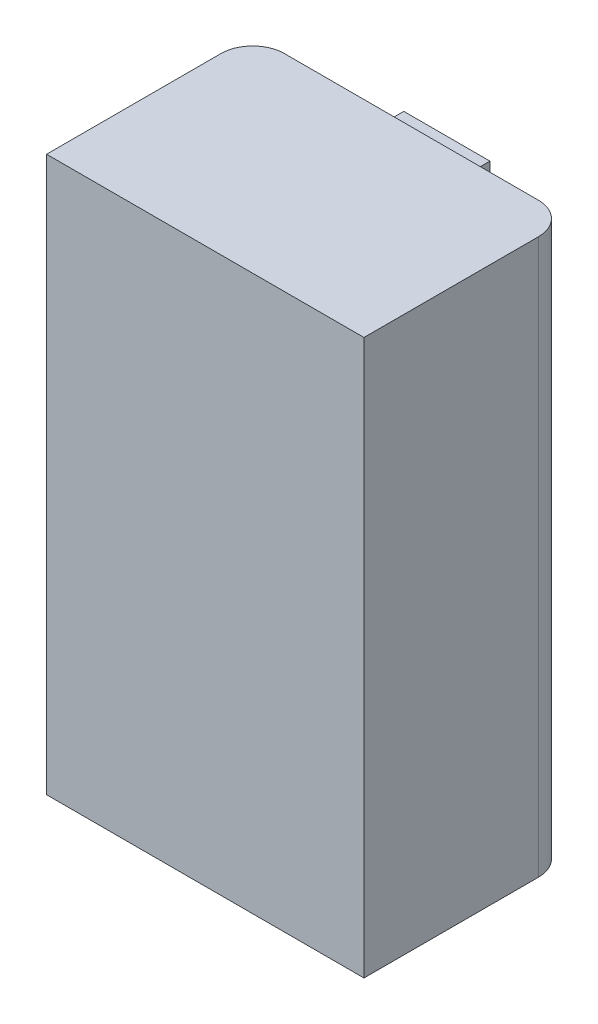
SolidWorks part; units mm, degrees
ref_plane "Front Plane" through (0, 0, 0) normal (0, 0, 1) x (1, 0, 0)
ref_plane "Top Plane" through (0, 0, 0) normal (0, 1, 0) x (1, 0, 0)
ref_plane "Right Plane" through (0, 0, 0) normal (1, 0, 0) x (0, 0, -1)
sketch "Sketch2" plane through (0, 0, 0) normal (0, 1, 0) x (1, 0, 0)
  line L1 (0, 0) -> (20.0259, 0)
  line L2 (0, 0) -> (0, 13.0038)
  line L3 (0, 13.0038) -> (20.0259, 13.0038)
  line L4 (20.0259, 0) -> (20.0259, 13.0038)
extrude "Boss-Extrude1" add sketch "Sketch2" along normal blind 35
sketch "Sketch4" plane through (0, 0, 0) normal (0, -1, 0) x (-1, 0, 0)
  line L5 (-17.4253, 9.8333) -> (-2.6086, 9.8333)
  line L6 (-17.4253, 9.8333) -> (-17.4253, 3.3005)
  line L7 (-17.4253, 3.3005) -> (-2.6086, 3.3005)
  line L8 (-2.6086, 9.8333) -> (-2.6086, 3.3005)
extrude "Cut-Extrude1" cut sketch "Sketch4" against normal blind 6
fillet "Fillet1" radius 2 2 edges at (20.0259, 17.5, -13.0038) (0, 17.5, -13.0038)
sketch "Sketch5" plane through (0, 0, -13.0038) normal (0, 0, -1) x (-1, 0, 0)
  text T0 "DUY 1" font "Franklin Gothic Medium" height in points 22
extrude "Boss-Extrude2" add sketch "Sketch5" along normal blind 1.5
